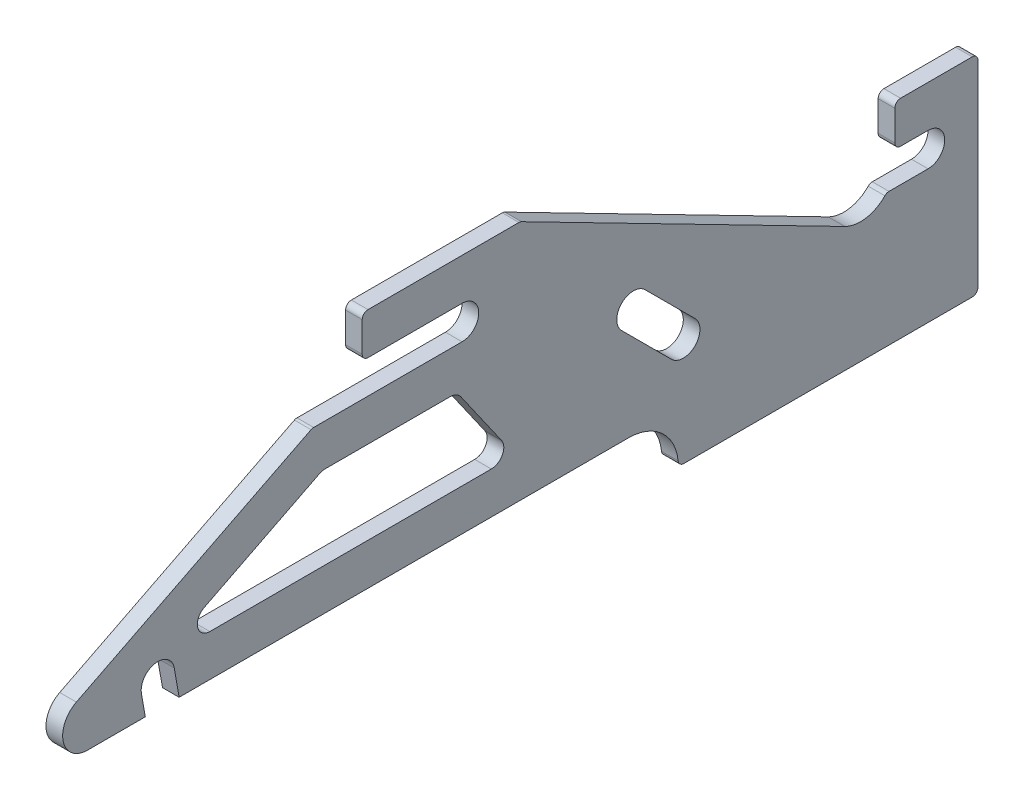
SolidWorks part; units mm, degrees
ref_plane "Plano frontal" through (0, 0, 0) normal (0, 0, 1) x (1, 0, 0)
ref_plane "Plano superior" through (0, 0, 0) normal (0, 1, 0) x (1, 0, 0)
ref_plane "Plano direito" through (0, 0, 0) normal (1, 0, 0) x (0, 0, -1)
sketch "Esboço1" plane through (0, 0, 0) normal (1, 0, 0) x (0, 0, -1)
  line L0 (0, 24.3036) -> (0, 0.6964)
  line L1 (-0.6964, 0) -> (-35.3399, 0)
  line L2 (-42, 6) -> (-96, 6)
  line L3 (-108.3527, 11.6777) -> (-80.1481, 25.9252)
  line L4 (-79.8341, 26) -> (-62, 26)
  line L5 (-62, 30) -> (-73.3036, 30)
  line L6 (-74, 30.6964) -> (-74, 34.3036)
  line L7 (-73.3036, 35) -> (-55.1682, 35)
  line L8 (-54.8504, 34.9233) -> (-16, 15)
  line L9 (-10.6921, 16) -> (-6, 16)
  line L10 (-6, 20) -> (-9.3036, 20)
  line L11 (-10, 20.6964) -> (-10, 24.3036)
  line L12 (-9.3036, 25) -> (-0.6964, 25)
  line L13 (-92.3088, 11) -> (-58.486, 11)
  line L14 (-96.5902, 9.3473) -> (-96, 6)
  line L15 (-100.5294, 8.6527) -> (-100.0617, 6)
  line L16 (-100.0617, 6) -> (-107, 6)
  line L17 (-57.2572, 13.3602) -> (-62.1572, 20.3602)
  line L18 (-63.386, 21) -> (-78.4515, 21)
  line L19 (-79.1278, 20.8389) -> (-92.9851, 13.8389)
  arc A0 (-36.0325, 0.624) -> (-42, 6) centre (-42, 0) ccw
  arc A1 (-107, 6) -> (-108.3527, 11.6777) centre (-107, 9) cw
  arc A2 (-62, 26) -> (-62, 30) centre (-62, 28) ccw
  arc A3 (-16, 15) -> (-11.1913, 15.7892) centre (-14.1295, 18.6475) ccw
  arc A4 (-6, 16) -> (-6, 20) centre (-6, 18) ccw
  arc A5 (-35.3399, 0) -> (-36.0325, 0.624) centre (-35.3399, 0.6964) cw
  arc A6 (0, 0.6964) -> (-0.6964, 0) centre (-0.6964, 0.6964) cw
  arc A7 (0, 24.3036) -> (-0.6964, 25) centre (-0.6964, 24.3036) ccw
  arc A8 (-10, 24.3036) -> (-9.3036, 25) centre (-9.3036, 24.3036) cw
  arc A9 (-9.3036, 20) -> (-10, 20.6964) centre (-9.3036, 20.6964) cw
  arc A10 (-11.1913, 15.7892) -> (-10.6921, 16) centre (-10.6921, 15.3036) cw
  arc A11 (-55.1682, 35) -> (-54.8504, 34.9233) centre (-55.1682, 34.3036) cw
  arc A12 (-74, 34.3036) -> (-73.3036, 35) centre (-73.3036, 34.3036) cw
  arc A13 (-73.3036, 30) -> (-74, 30.6964) centre (-73.3036, 30.6964) cw
  arc A14 (-80.1481, 25.9252) -> (-79.8341, 26) centre (-79.8341, 25.3036) cw
  arc A15 (-96.5902, 9.3473) -> (-100.5294, 8.6527) centre (-98.5598, 9) ccw
  arc A16 (-78.4515, 21) -> (-79.1278, 20.8389) centre (-78.4515, 19.5) ccw
  arc A17 (-62.1572, 20.3602) -> (-63.386, 21) centre (-63.386, 19.5) ccw
  arc A18 (-58.486, 11) -> (-57.2572, 13.3602) centre (-58.486, 12.5) ccw
  arc A19 (-92.3088, 11) -> (-92.9851, 13.8389) centre (-92.3088, 12.5) cw
  point P26 (-36, 0)
  point P29 (0, 0)
  point P32 (0, 25)
  point P35 (-10, 25)
  point P40 (-11, 16)
  point P43 (-55, 35)
  point P50 (-80, 26)
  point P64 (-62.605, 21)
  point P67 (-55.605, 11)
  point P70 (-98.605, 11)
  dimension "D3" = 110
  dimension "D4" = 3
  dimension "D20" = 0.6964
  dimension "D30" = 1.5
  dimension "D1" = 25
  dimension "D2" = 36
  dimension "D5" = 80
  dimension "D6" = 20
  dimension "D7" = 6
  dimension "D8" = 35
  dimension "D9" = 30
  dimension "D10" = 74
  dimension "D11" = 14
  dimension "D12" = 10
  dimension "D13" = 20
  dimension "D14" = 16
  dimension "D15" = 4
  dimension "D16" = 11
  dimension "D17" = 16
  dimension "D18" = 15
  dimension "D19" = 55
  dimension "D21" = 4
  dimension "D22" = 80
  dimension "D23" = 5
  dimension "D24" = 96
  dimension "D25" = 10
  dimension "D26" = 43
  dimension "D27" = 5
  dimension "D28" = 7
  dimension "D29" = 5
extrude "Ressalto-extrusão1" add sketch "Esboço1" along normal blind 2
sketch "Esboço2" plane through (2, 0, 0) normal (1, 0, 0) x (0, 0, -1)
  line L0 (-41.4142, 19) -> (-35.4142, 13) construction
  line L1 (-40, 20.4142) -> (-34, 14.4142)
  line L2 (-42.8284, 17.5858) -> (-36.8284, 11.5858)
  line L3 (0, 0.6964) -> (0, 24.3036) construction
  line L4 (-35.3399, 0) -> (-0.6964, 0) construction
  arc A0 (-40, 20.4142) -> (-42.8284, 17.5858) centre (-41.4142, 19) ccw
  arc A1 (-36.8284, 11.5858) -> (-34, 14.4142) centre (-35.4142, 13) ccw
  point P2 (-38.4142, 16)
  dimension "D4" = 6
  dimension "D1" = 4
  dimension "D2" = 40
  dimension "D3" = 34
  dimension "D5" = 11
extrude "Corte-extrusão1" cut sketch "Esboço2" against normal through all
